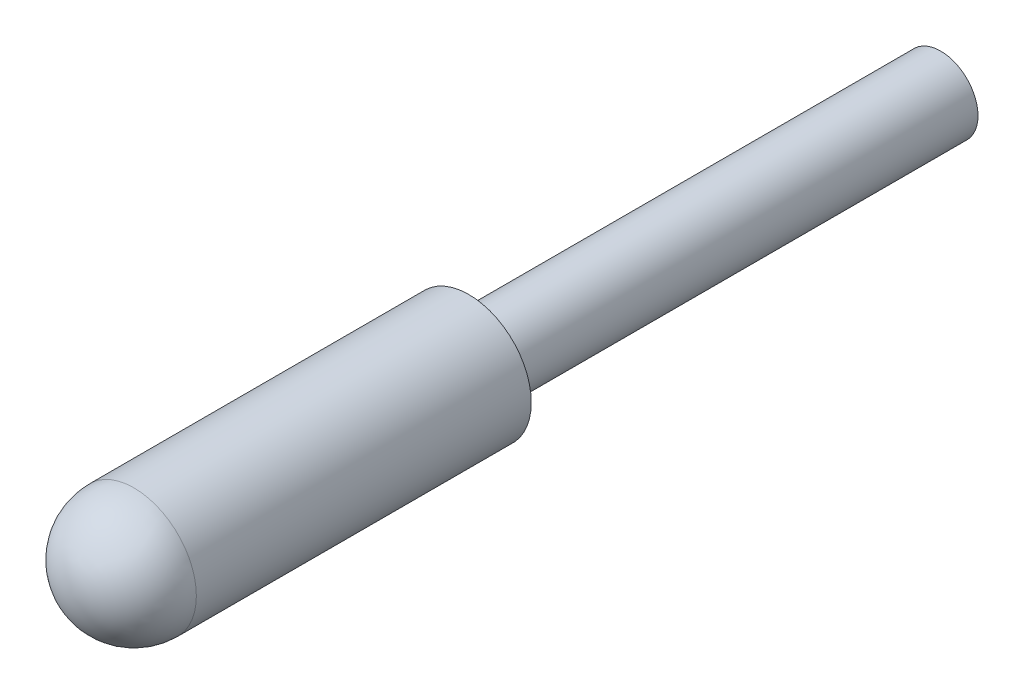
SolidWorks part; units mm, degrees
ref_plane "Спереди" through (0, 0, 0) normal (0, 0, 1) x (1, 0, 0)
ref_plane "Сверху" through (0, 0, 0) normal (0, 1, 0) x (1, 0, 0)
ref_plane "Справа" through (0, 0, 0) normal (1, 0, 0) x (0, 0, -1)
sketch "Эскиз1" plane through (0, 0, 0) normal (1, 0, 0) x (0, 0, -1)
  line L0 (0, 0) -> (57.9127, 0) construction
  line L1 (0, 0) -> (27.7812, 0)
  line L2 (27.7812, 0) -> (27.7812, 1.1938)
  line L3 (27.7812, 1.1938) -> (13.0969, 1.1938)
  line L4 (12.7, 1.5907) -> (12.7, 1.9939)
  line L5 (12.7, 1.9939) -> (1.9939, 1.9939)
  arc A0 (1.9939, 1.9939) -> (0, 0) centre (1.9939, 0) ccw
  arc A1 (13.0969, 1.1938) -> (12.7, 1.5907) centre (13.0969, 1.5907) cw
  dimension "D5" = 0.3969
  dimension "D1" = 12.7
  dimension "D2" = 27.7812
  dimension "D3" = 3.9878
  dimension "D4" = 2.3876
revolve "Повернуть1" add sketch "Эскиз1" angle 360 about L0
